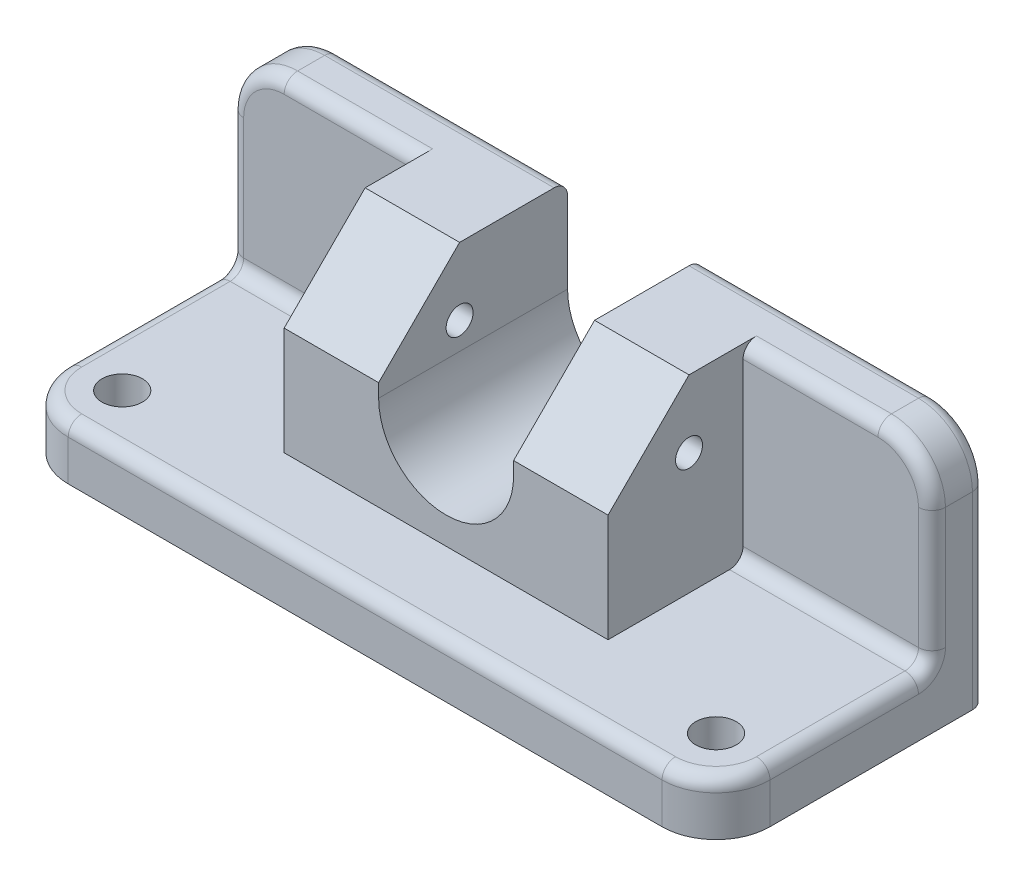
SolidWorks part; units mm, degrees
ref_plane "Front Plane" through (0, 0, 0) normal (0, 0, 1) x (1, 0, 0)
ref_plane "Top Plane" through (0, 0, 0) normal (0, 1, 0) x (1, 0, 0)
ref_plane "Right Plane" through (0, 0, 0) normal (1, 0, 0) x (0, 0, -1)
sketch "Sketch1" plane through (0, 0, 0) normal (0, 1, 0) x (1, 0, 0)
  line L1 (-65, -50) -> (65, -50)
  line L2 (-65, -50) -> (-65, 50)
  line L3 (-65, 50) -> (65, 50)
  line L4 (65, -50) -> (65, 50)
  line L5 (-65, -50) -> (65, 50) construction
  line L6 (-65, 50) -> (65, -50) construction
  point P0 (0, 0)
  dimension "D1" = 100
  dimension "D2" = 130
extrude "Boss-Extrude1" add sketch "Sketch1" along normal blind 20
sketch "Sketch2" plane through (0, 20, 0) normal (0, 1, 0) x (1, 0, 0)
  line L0 (65, -50) -> (65, 50) construction
  line L1 (-65, 50) -> (65, 50)
  line L2 (-65, 50) -> (-65, 30)
  line L3 (-65, 30) -> (65, 30)
  line L4 (65, 50) -> (65, 30)
  dimension "D1" = 20
extrude "Boss-Extrude2" add sketch "Sketch2" along normal blind 70
fillet "Fillet1" radius 20 2 edges at (-65, 10, 50) (-65, 90, -40)
sketch "Sketch3" plane through (0, 0, -30) normal (0, 0, 1) x (1, 0, 0)
  line L0 (-45, 90) -> (65, 90) construction
  line L1 (65, 20) -> (5, 20)
  line L2 (65, 20) -> (65, 90)
  line L3 (65, 90) -> (5, 90)
  line L4 (5, 20) -> (5, 90)
  dimension "D1" = 60
extrude "Boss-Extrude3" add sketch "Sketch3" along normal blind 50
sketch "Sketch4" plane through (0, 0, 20) normal (0, 0, 1) x (1, 0, 0)
  line L0 (40, 90) -> (40, 55)
  line L1 (65, 90) -> (5, 90) construction
  line L2 (65, 20) -> (65, 90) construction
  line L7 (65, 20) -> (65, 90)
  line L8 (65, 90) -> (5, 90)
  line L9 (5, 90) -> (5, 20)
  line L10 (5, 20) -> (65, 20)
  line L11 (65, 30) -> (65, 90)
  line L12 (65, 90) -> (40, 90)
  arc A0 (40, 55) -> (65, 30) centre (65, 55) ccw
  dimension "D2" = 25
  dimension "D1" = 25
  dimension "D3" = 35
  dimension "D4" = 0
extrude "Cut-Extrude1" cut sketch "Sketch4" against normal through all
chamfer "Chamfer1" distance 30 angle 45 1 edges at (22.5, 90, 20)
hole_wizard "Ø10.0 (10) Diameter Hole1" positions "Sketch6" profile "Sketch5" hole size "Ø10.0" standard "ANSI Metric"
sketch "Sketch6" plane through (5, 0, 0) normal (-1, 0, 0) x (0, 0, 1)
  line L0 (20, 60) -> (20, 20) construction
  line L1 (20, 20) -> (-30, 20) construction
  point P0 (-10, 65)
  dimension "D1" = 30
  dimension "D2" = 45
sketch "Sketch5" plane through (5, 65, -10) normal (0, 1, 0) x (0, 0, 1)
  line L0 (0, 0) -> (0, 60)
  line L1 (0, 60) -> (5, 60)
  line L2 (5, 60) -> (5, 0)
  line L5 (5, 0) -> (0, 0)
  line L11 (0, -6.35) -> (0, 107.95) construction
  dimension "Thru Hole Dia." = 10
  dimension "Thru Hole Depth" = 60
hole_wizard "Ø15.0 (15) Diameter Hole1" positions "Sketch8" profile "Sketch7" hole size "Ø15.0" standard "ANSI Metric"
sketch "Sketch8" plane through (0, 20, 0) normal (0, 1, 0) x (1, 0, 0)
  point P0 (-45, -30)
sketch "Sketch7" plane through (-45, 20, 30) normal (1, 0, 0) x (0, 0, 1)
  line L0 (0, 0) -> (0, 20)
  line L1 (0, 20) -> (7.5, 20)
  line L2 (7.5, 20) -> (7.5, 0)
  line L5 (7.5, 0) -> (0, 0)
  line L11 (0, -6.35) -> (0, 107.95) construction
  dimension "Thru Hole Dia." = 15
  dimension "Thru Hole Depth" = 20
fillet "Fillet2" radius 5 10 edges at (10, 20, 50) (-65, 35, -50) (-2.5, 90, -50) (-20, 90, -30) (-59.1421, 20, 44.1421) (-59.1421, 84.1421, -50) (-59.1421, 84.1421, -30)
mirror "Mirror1" about plane through (65, 20, 50) normal (-1, 0, 0)
